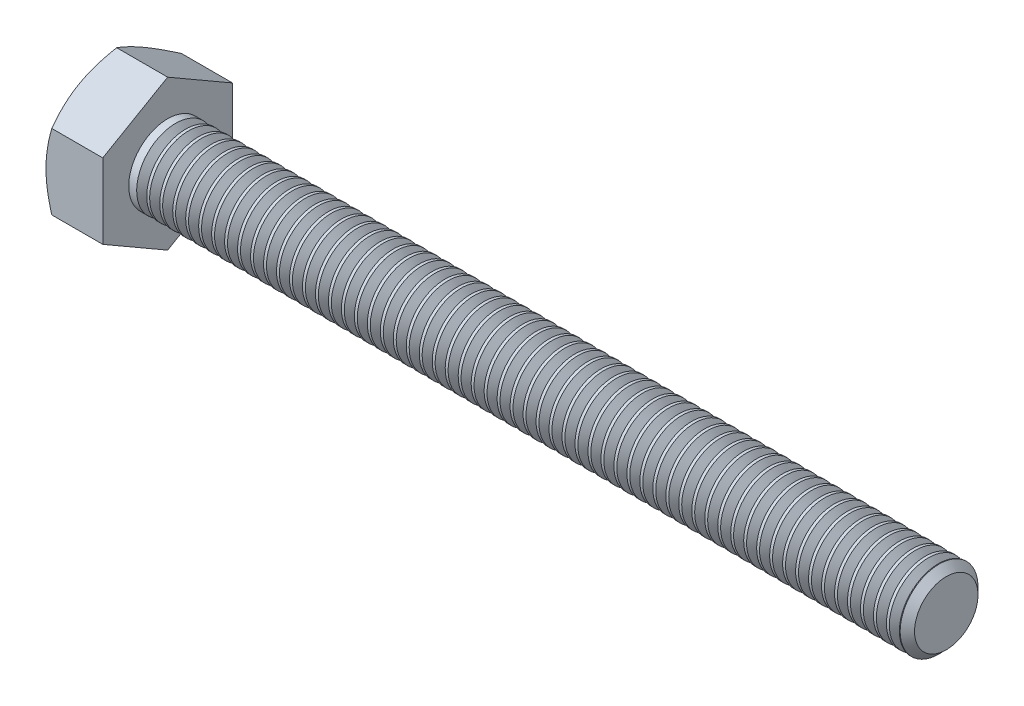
SolidWorks part; units mm, degrees
extrude "BaseHead" add sketch "Sketch1" along normal blind 4.375
sketch "Sketch1" plane through (0, 0, 0) normal (1, 0, 0) x (0, 0, -1)
  line L0 (5, 2.8868) -> (5, -2.8868)
  line L1 (-5, 2.8868) -> (-5, -2.8868)
  line L2 (5, -2.8868) -> (0, -5.7735)
  line L3 (0, -5.7735) -> (-5, -2.8868)
  line L4 (5, 2.8868) -> (0, 5.7735)
  line L5 (0, 5.7735) -> (-5, 2.8868)
revolve "HeadChamfer" cut sketch "Sketch3" angle 360 about L6
sketch "Sketch3" plane through (0, 0, 0) normal (0, 0, 1) x (1, 0, 0)
  line L0 (0, 5) -> (3.3333, 10.7735)
  line L1 (0, 5.7735) -> (0, 2.8868) construction
  line L2 (3.3333, 10.7735) -> (3.3333, 15.7735)
  line L3 (3.3333, 15.7735) -> (-10, 15.7735)
  line L4 (-10, 15.7735) -> (-10, 5)
  line L5 (-10, 5) -> (0, 5)
  line L6 (0, 0) -> (99.06, 0) construction
  line L7 (4.375, 5.7735) -> (0, 5.7735) construction
ref_plane "Plane1" through (0, 0, 0) normal (0, 0, 1) x (1, 0, 0)
ref_plane "Plane2" through (0, 0, 0) normal (0, 1, 0) x (1, 0, 0)
ref_plane "Plane3" through (0, 0, 0) normal (1, 0, 0) x (0, 0, -1)
sketch "BodySke" plane through (0, 0, 0) normal (0, 0, 1) x (1, 0, 0)
  line L0 (0, 2.8868) -> (0, -2.8868) construction
  line L1 (0, 0) -> (64.375, 0)
  line L2 (0, 0) -> (0, 3)
  line L3 (0, 3) -> (63.8205, 3)
  line L4 (64.375, 0) -> (64.375, 2.4455)
  line L5 (4.375, 5.7735) -> (4.375, 2.8868) construction
  line L6 (64.375, 2.4455) -> (63.8205, 3)
  line L7 (0, 0) -> (96.52, 0) construction
  line L8 (64.375, -2.4455) -> (63.8205, -3) construction
  line L9 (0, -3) -> (63.8205, -3) construction
  line L10 (5.375, 15.24) -> (5.375, -1.27) construction
  line L12 (4.375, 2.8868) -> (4.375, -2.8868) construction
revolve "BaseBody" add sketch "BodySke"
fillet "HeadFillet" [suppressed] radius 0.25
sketch "Sketch4" plane through (0, 0, 0) normal (0, 0, 1) x (1, 0, 0)
  line L1 (4.375, 5.7735) -> (4.375, 2.8868) construction
  line L2 (4.375, 5) -> (3.875, 5)
  line L3 (4.375, 5) -> (4.375, 15.7735)
  line L4 (4.375, 15.7735) -> (3.875, 15.7735)
  line L5 (0, 0) -> (95.25, 0) construction
  line L6 (0, 0) -> (96.52, 0) construction
  line L7 (3.875, 5) -> (3.875, 15.7735)
  line L8 (4.375, 5.7735) -> (0.4466, 5.7735) construction
revolve "BearingFace" [suppressed] cut sketch "Sketch4" angle 360 about L5
sketch "ThdSchSke" plane through (0, 0, 0) normal (0, 0, 1) x (1, 0, 0)
  line L0 (5.375, -2.4455) -> (4.9867, -3)
  line L1 (5.375, -2.4455) -> (5.7633, -3)
  line L2 (5.7633, -3) -> (5.7633, -3.75)
  line L3 (-3.175, 0) -> (5.1513, 0) construction
  line L5 (5.7633, -3.75) -> (4.9867, -3.75)
  line L6 (4.9867, -3.75) -> (4.9867, -3)
revolve "ThreadSchematic" cut sketch "ThdSchSke" angle 360 about L3
pattern_linear "ThdSchPat" count 59 spacing 1 along (1, 0, 0) of "ThreadSchematic"
equation "\"D3@Sketch1\" = \"Width_flats@Sketch1\" / 2"
equation "\"D4@Sketch1\" = \"D3@Sketch1\""
equation "\"D5@Sketch1\" = \"D4@Sketch1\""
equation "\"Thread_minor@ThreadCosmetic\" = \"Minor_dia@BodySke\""
equation "\"D1@Sketch3\" = \"Width_flats@Sketch1\" / 2"
equation "\"D1@Sketch4\" = \"Width_flats@Sketch1\""
equation "\"Thread_length@ThreadCosmetic\" = \"Length@BodySke\" - \"Advance@BodySke\""
equation "\"Thread_minor@ThdSchSke\" = \"Minor_dia@BodySke\""
equation "\"Diameter@ThdSchSke\" = \"Diameter@BodySke\""
equation "\"Overcut@ThdSchSke\" = \"Diameter@BodySke\" * 1.25"
equation "\"Start@ThdSchSke\" = \"Head_ht@BaseHead\" + \"Length@BodySke\" - \"Thread_length@ThreadCosmetic\"  '---Non-countersunk---"
equation "\"Num_threads@ThdSchPat\" = int( \"Thread_length@ThreadCosmetic\" / \"Advance@BodySke\" + 0.999 )  + 1"
equation "\"Advance@ThdSchPat\" = \"Thread_length@ThreadCosmetic\" /  (\"Num_threads@ThdSchPat\" - 1) 'relax it"
equation "\"Num_threads@ThdSchPat\" = \"Num_threads@ThdSchPat\" - sgn( \"Num_threads@ThdSchPat\" - 1) '---chamfered tips only---"
